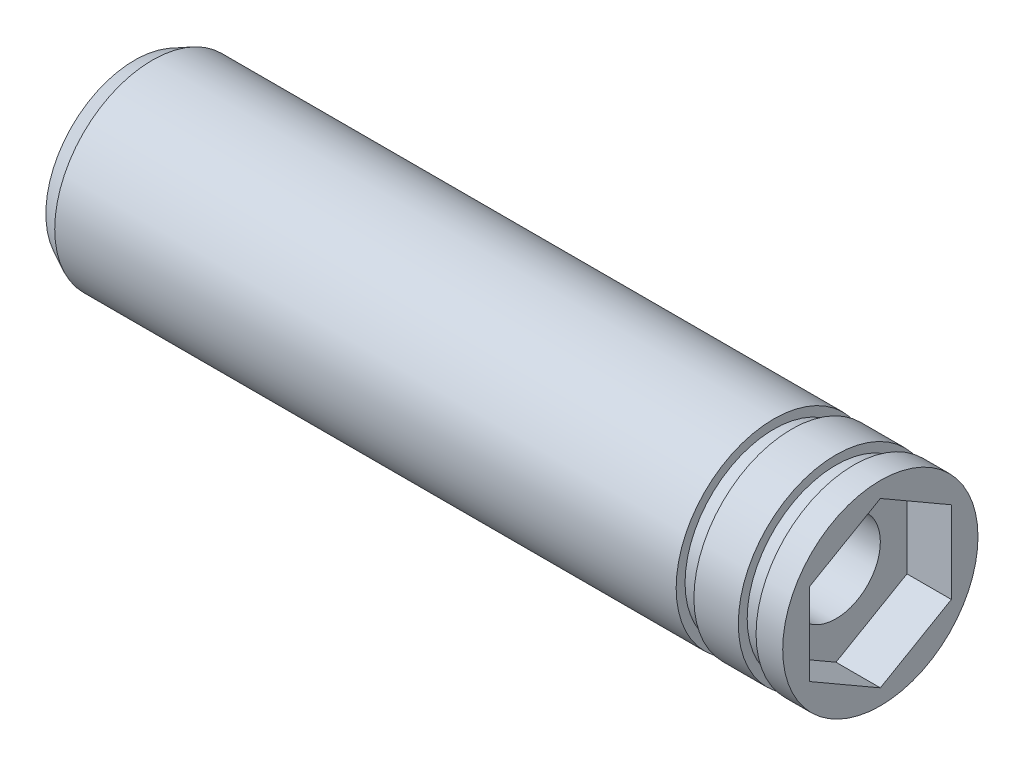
SolidWorks part; units mm, degrees
ref_plane "Plan1" through (0, 0, 0) normal (0, 0, 1) x (1, 0, 0)
ref_plane "Plan2" through (0, 0, 0) normal (0, 1, 0) x (1, 0, 0)
ref_plane "Plan3" through (0, 0, 0) normal (1, 0, 0) x (0, 0, -1)
sketch "Esquisse1" plane through (0, 0, 0) normal (0, 0, 1) x (1, 0, 0)
  line L0 (0, 0) -> (120, 0) construction
  line L1 (0, 0) -> (0, 5.5)
  line L2 (0, 5.5) -> (36, 5.5)
  line L3 (36, 5.5) -> (36, 5)
  line L4 (36, 5) -> (37, 5)
  line L5 (37, 5) -> (37, 5.5)
  line L6 (37, 5.5) -> (39.5, 5.5)
  line L7 (39.5, 5.5) -> (39.5, 5)
  line L8 (42, 0) -> (0, 0)
  line L9 (39.5, 5) -> (40.5, 5)
  line L10 (40.5, 5) -> (40.5, 5.5)
  line L11 (40.5, 5.5) -> (42, 5.5)
  line L12 (42, 5.5) -> (42, 0)
  line L13 (37, 8) -> (37, -8) construction
  dimension "D1" = 42
  dimension "D2" = 11
  dimension "D3" = 1
  dimension "D4" = 2.5
  dimension "D5" = 0.5
revolve "Base-Révolution" add sketch "Esquisse1" angle 360 about L0
chamfer "Chanfrein1" distance 1 distance2 0.5
sketch "Esquisse2" plane through (0, 0, 0) normal (-1, 0, 0) x (0, 0, 1)
  line L1 (3.25, -1.8764) -> (3.25, 1.8764)
  line L2 (3.25, 1.8764) -> (0, 3.7528)
  line L3 (0, 3.7528) -> (-3.25, 1.8764)
  line L4 (-3.25, 1.8764) -> (-3.25, -1.8764)
  line L5 (-3.25, -1.8764) -> (0, -3.7528)
  line L6 (0, -3.7528) -> (3.25, -1.8764)
  circle A0 centre (0, 0) radius 3.25 construction
  dimension "D1" = 6.5
extrude "Enlèv. mat.-Extru.1" cut sketch "Esquisse2" against normal blind 20
sketch "Esquisse3" plane through (42, 0, 0) normal (1, 0, 0) x (0, 0, -1)
  circle A0 centre (0, 0) radius 2.5
  dimension "D1" = 5
extrude "Enlèv. mat.-Extru.2" cut sketch "Esquisse3" against normal through all
sketch "Esquisse4" plane through (20, 0, 0) normal (-1, 0, 0) x (0, 0, 1)
  circle A0 centre (0, 0) radius 3
  dimension "D1" = 6
extrude "Enlèv. mat.-Extru.3" cut sketch "Esquisse4" against normal blind 7
sketch "Esquisse8" plane through (0, 0, 0) normal (0, 1, 0) x (1, 0, 0)
  line L0 (0, 0) -> (5.3976, 0) construction
  line L1 (7, 3.25) -> (8, 3.25)
  line L2 (7, 3.25) -> (7, 4)
  line L3 (7, 4) -> (8, 4)
  line L4 (8, 3.25) -> (8, 4)
  line L5 (27, 0) -> (42, 0) construction
  line L6 (20, 3.25) -> (0, 3.25) construction
  line L7 (0, 5) -> (0, -5) construction
  dimension "D1" = 1
  dimension "D2" = 8
  dimension "D3" = 7
revolve "Enlèvement de matière-Révolution1" cut sketch "Esquisse8" angle 360 about L0
sketch "Esquisse9" plane through (42, 0, 0) normal (1, 0, 0) x (0, 0, -1)
  line L0 (0, 50) -> (0, -50) construction
  line L1 (0, -4.6188) -> (4, -2.3094)
  line L2 (4, -2.3094) -> (4, 2.3094)
  line L3 (4, 2.3094) -> (0, 4.6188)
  line L4 (0, 4.6188) -> (-4, 2.3094)
  line L5 (-4, 2.3094) -> (-4, -2.3094)
  line L6 (-4, -2.3094) -> (0, -4.6188)
  circle A0 centre (0, 0) radius 4 construction
  circle A1 centre (0, 0) radius 5.5 construction
  dimension "D1" = 8
extrude "Enlèv. mat.-Extru.4" cut sketch "Esquisse9" against normal blind 2.5
